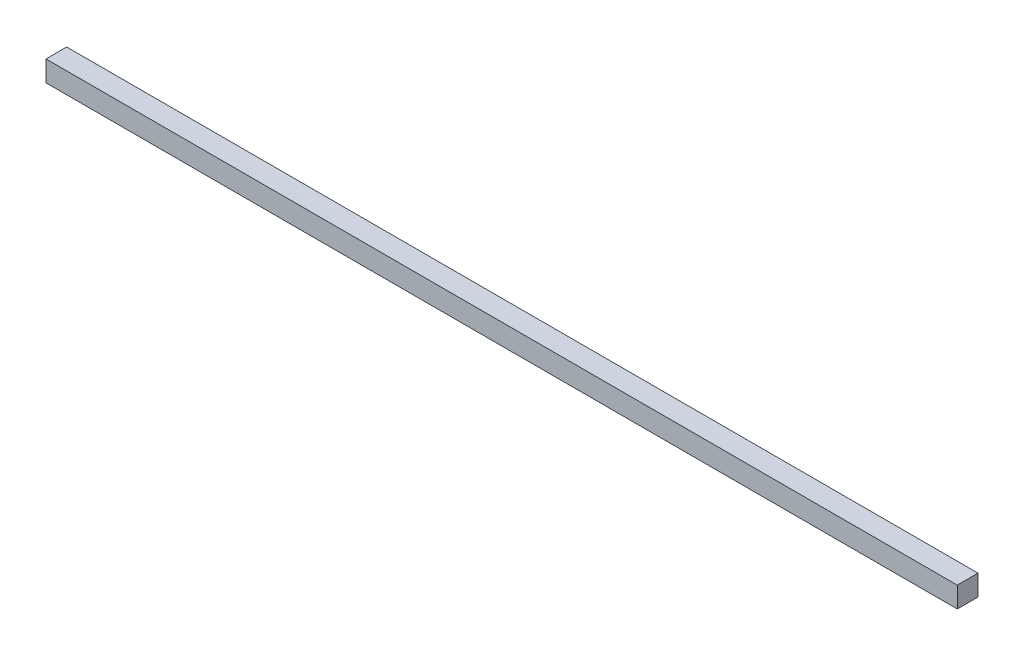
SolidWorks part; units mm, degrees
ref_plane "正面" through (0, 0, 0) normal (1, 0, 0) x (0, 1, 0)
ref_plane "平面" through (0, 0, 0) normal (0, 0, 1) x (0, 1, 0)
ref_plane "右側面" through (0, 0, 0) normal (0, 1, 0) x (-1, 0, 0)
sketch "ｽｹｯﾁ1" plane through (0, 0, 0) normal (1, 0, 0) x (0, 1, 0)
  line L1 (-5, 5) -> (5, 5)
  line L2 (-5, 5) -> (-5, -5)
  line L3 (-5, -5) -> (5, -5)
  line L4 (5, 5) -> (5, -5)
  line L5 (-5, 5) -> (5, -5) construction
  line L6 (-5, -5) -> (5, 5) construction
  point P0 (0, 0)
  dimension "D1" = 10
  dimension "D2" = 10
extrude "ﾎﾞｽ - 押し出し1" add sketch "ｽｹｯﾁ1" along normal blind 440
